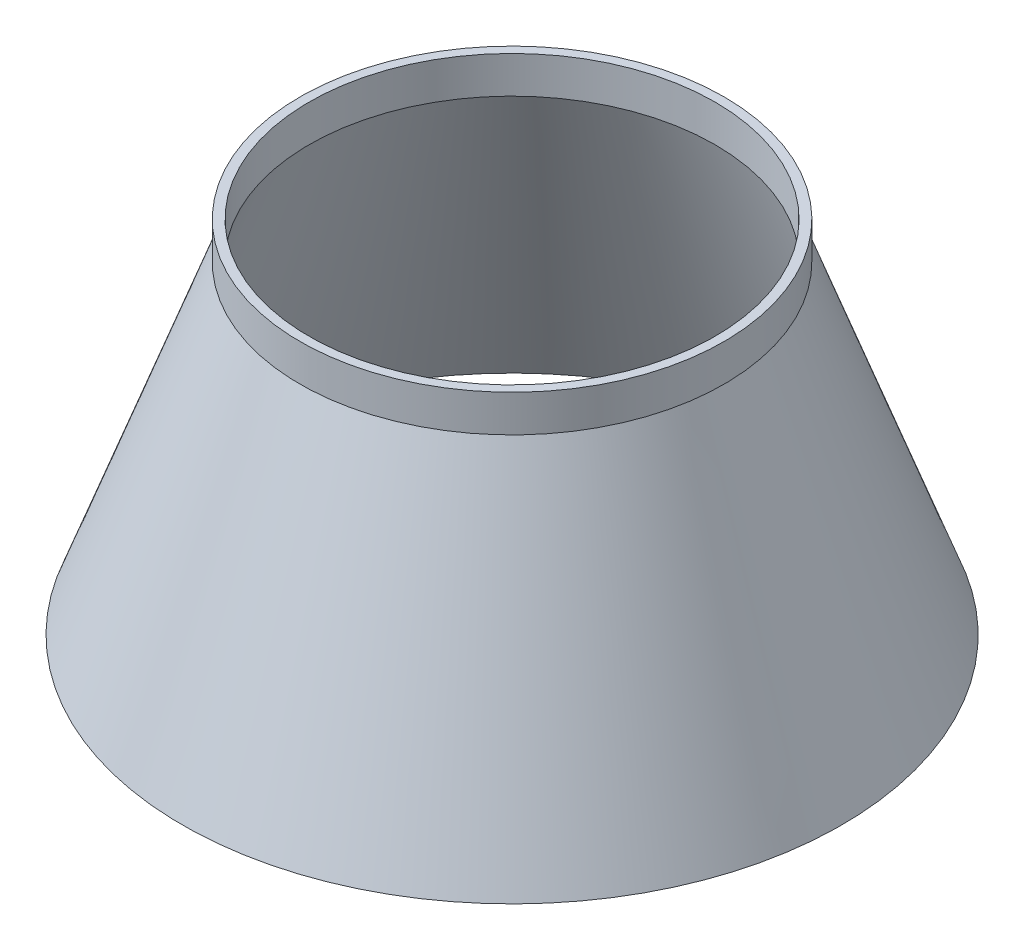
SolidWorks part; units mm, degrees
ref_plane "前视基准面" through (0, 0, 0) normal (0, 0, 1) x (1, 0, 0)
ref_plane "上视基准面" through (0, 0, 0) normal (0, 1, 0) x (1, 0, 0)
ref_plane "右视基准面" through (0, 0, 0) normal (1, 0, 0) x (0, 0, -1)
sketch "草图1" plane through (0, 0, 0) normal (0, 0, 1) x (1, 0, 0)
  line L0 (0, 0) -> (0, 66192.6951) construction
  line L1 (45, 79.8) -> (47, 79.8)
  line L2 (47, 79.8) -> (47, 71.6093)
  line L3 (47, 71.6093) -> (73.0637, 0)
  line L4 (73.0637, 0) -> (71.0637, 0)
  line L5 (71.0637, 0) -> (45, 71.6093)
  line L6 (45, 71.6093) -> (45, 79.8)
  point P3 (53.6518, 115.6081)
  point P5 (0, 0)
  point P11 (47, 71.6093)
  dimension "D1" = 45
  dimension "D2" = 110
  dimension "D3" = 2
  dimension "D4" = 79.8
revolve "旋转1" add sketch "草图1" angle 360 about L0
